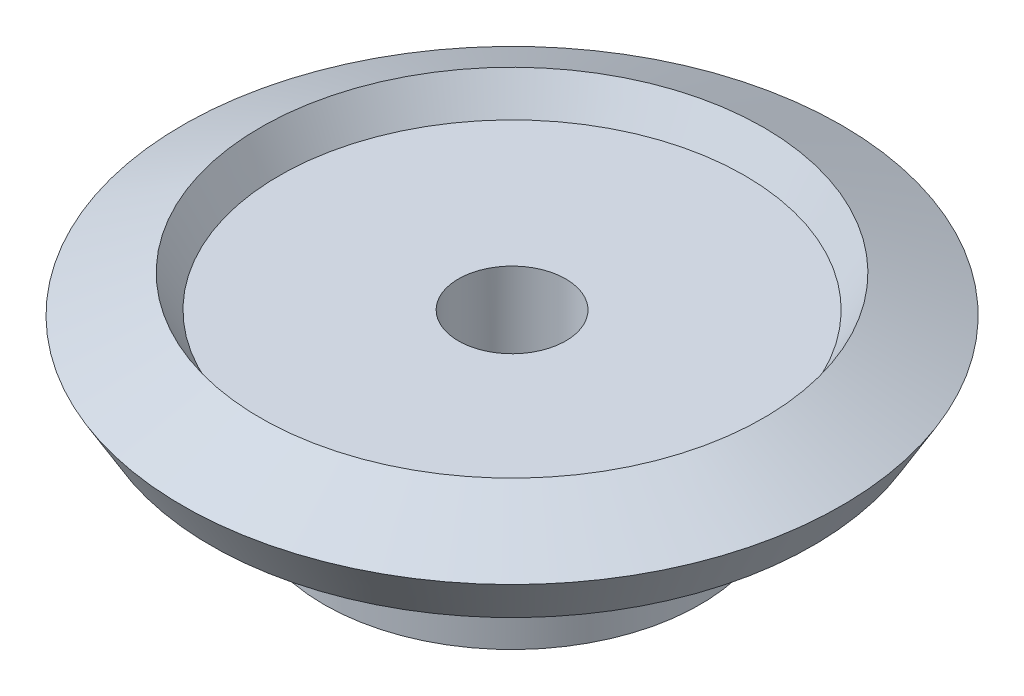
SolidWorks part; units mm, degrees
ref_plane "Face" through (0, 0, 0) normal (0, 0, 1) x (1, 0, 0)
ref_plane "Dessus" through (0, 0, 0) normal (0, 1, 0) x (1, 0, 0)
ref_plane "Droite" through (0, 0, 0) normal (1, 0, 0) x (0, 0, -1)
sketch "Esquisse1" plane through (0, 0, 0) normal (0, 0, 1) x (1, 0, 0)
  line L0 (0, 0) -> (0, 56.2487) construction
  line L1 (30, 13.41) -> (0, 28.41) construction
  line L2 (5, 0) -> (17.5, 0)
  line L3 (5, 0) -> (5, 15)
  line L4 (28, 10) -> (30.67, 14.5524)
  line L5 (28, 10) -> (17.5, 10)
  line L6 (21.6581, 15) -> (23.4176, 18)
  line L7 (23.4176, 18) -> (30.67, 14.5524)
  line L8 (17.5, 10) -> (17.5, 0)
  line L9 (21.6581, 15) -> (5, 15)
  dimension "D1" = 30
  dimension "D2" = 30.67
  dimension "D3" = 15
  dimension "D4" = 18
  dimension "D5" = 28.41
  dimension "D6" = 5
  dimension "D7" = 17.5
  dimension "D8" = 8
  dimension "D9" = 10
  dimension "D10" = 15
  dimension "D11" = 28
revolve "Révolution1" add sketch "Esquisse1" angle 360 about L0
ref_axis "Axe1" through (0, 0, 0) along (0, 1, 0)
ref_plane "Plan1" through (0, 28.41, 0) normal (0, -1, 0) x (1, 0, 0)
hole_wizard "Trou taraudé M4x0.71" positions "Esquisse3" profile "Esquisse2" tap size "M4x0.7" standard "Ansi Métrique"
sketch "Esquisse3" plane through (0, 0, 0) normal (0, 0, 1) x (1, 0, 0)
  line L0 (0, 0) -> (0, 10) construction
  point P0 (0, 6)
  dimension "D1" = 6
sketch "Esquisse2" plane through (0, 6, 0) normal (1, 0, 0) x (0, 1, 0)
  line L0 (0, 0) -> (0, 41.896)
  line L1 (0, 41.896) -> (1.65, 41.896)
  line L2 (1.65, 41.896) -> (1.65, 0)
  line L5 (1.65, 0) -> (0, 0)
  line L11 (0, -6.35) -> (0, 107.95) construction
  dimension "Diamètre du trou pour taraudage jusqu'au prochain" = 3.3
  dimension "Profondeur du trou pour taraudage jusqu'au prochain" = 41.896
pattern_circular "Répétition circulaire1" count 3 over 360 about axis through (0, 0, 0) along (0, 1, 0) of "Trou taraudé M4x0.71"
